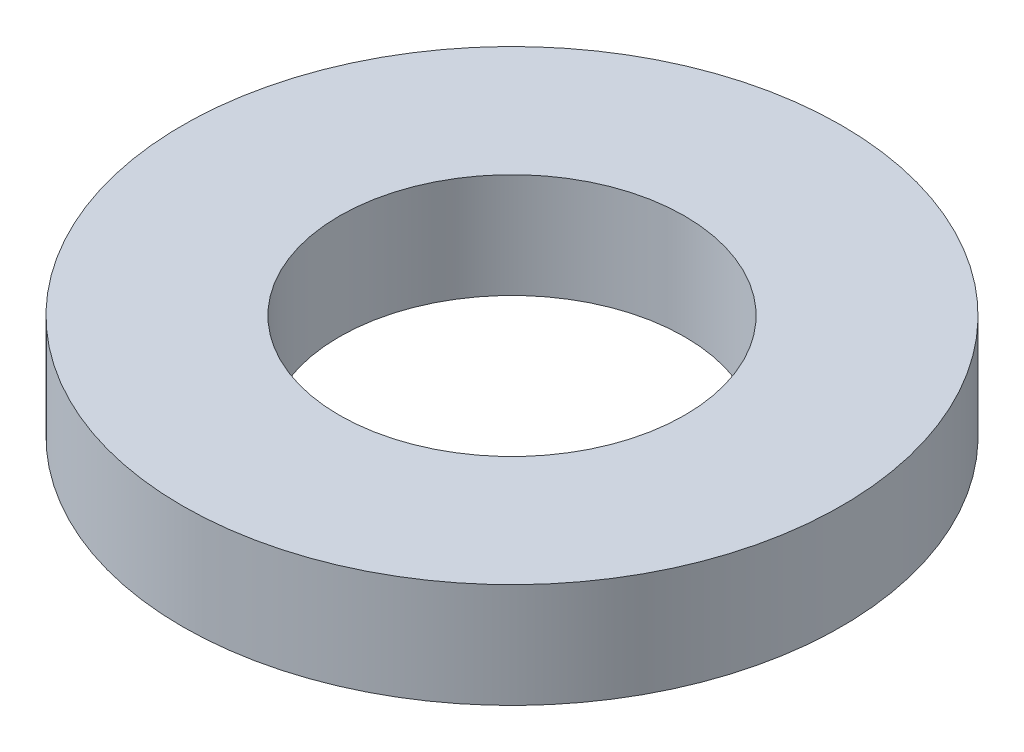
SolidWorks part; units mm, degrees
ref_plane "Front" through (0, 0, 0) normal (0, 0, 1) x (1, 0, 0)
ref_plane "Top" through (0, 0, 0) normal (0, 1, 0) x (1, 0, 0)
ref_plane "Right" through (0, 0, 0) normal (1, 0, 0) x (0, 0, -1)
sketch "Sketch1" plane through (0, 0, 0) normal (0, 1, 0) x (1, 0, 0)
  circle A0 centre (0, 0) radius 31.5
  circle A1 centre (0, 0) radius 16.5
  dimension "D1" = 33
  dimension "D2" = 63
extrude "Extrude1" add sketch "Sketch1" along normal blind 10
